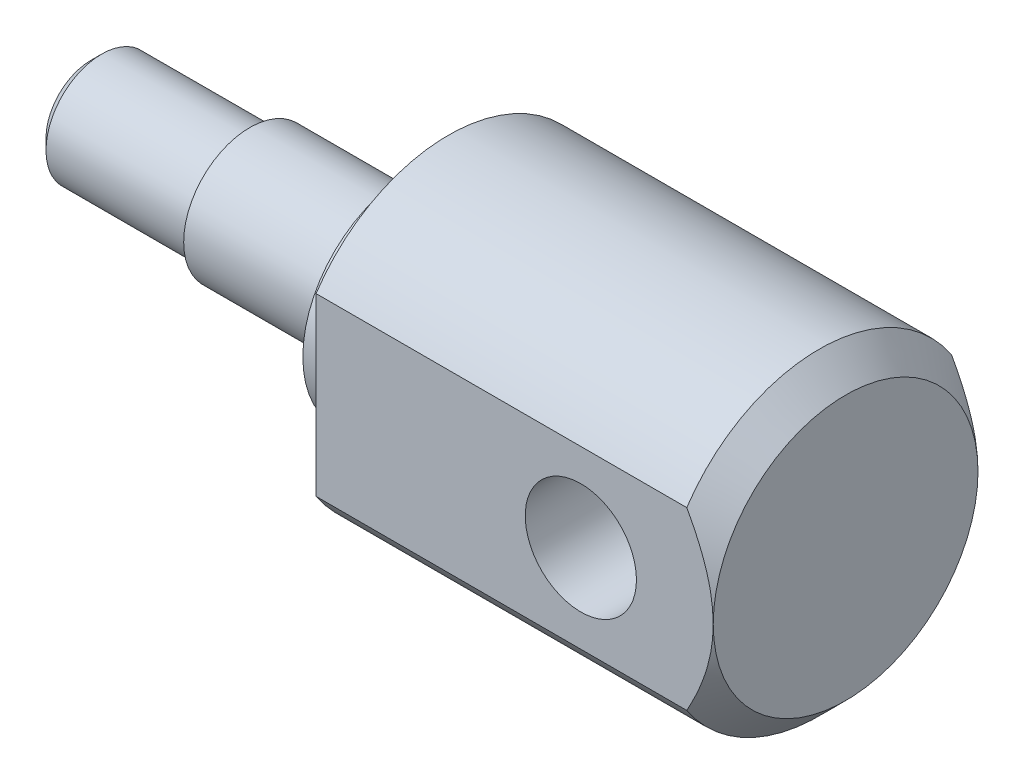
SolidWorks part; units mm, degrees
ref_plane "Front Plane" through (0, 0, 0) normal (0, 0, 1) x (1, 0, 0)
ref_plane "Top Plane" through (0, 0, 0) normal (0, 1, 0) x (1, 0, 0)
ref_plane "Right Plane" through (0, 0, 0) normal (1, 0, 0) x (0, 0, -1)
sketch "Sketch1" plane through (0, 0, 0) normal (0, 0, 1) x (1, 0, 0)
  line L0 (0, 0) -> (28.5, 0)
  line L1 (0, 0) -> (0, 2.1)
  line L2 (0, 2.1) -> (6, 2.1)
  line L3 (6, 2.1) -> (6, 2.5)
  line L4 (6, 2.5) -> (12, 2.5)
  line L5 (12, 2.5) -> (12, 4)
  line L6 (12, 4) -> (13.5, 4)
  line L7 (13.5, 4) -> (13.5, 6)
  line L8 (13.5, 6) -> (28.5, 6)
  line L9 (28.5, 6) -> (28.5, 0)
  dimension "D1" = 1.5
  dimension "D2" = 15
  dimension "D3" = 6
  dimension "D4" = 6
  dimension "D5" = 2.1
  dimension "D6" = 2.5
  dimension "D7" = 4
  dimension "D8" = 6
revolve "Revolve1" add sketch "Sketch1" angle 360 about L0
chamfer "Chamfer1" distance 0.4 angle 45 1 edges at (0, 0, 2.1)
chamfer "Chamfer2" distance 1 angle 45 1 edges at (28.5, 0, 6)
sketch "Sketch2" plane through (0, 0, 0) normal (0, 1, 0) x (1, 0, 0)
  line L0 (0, 0) -> (28.5, 0) construction
  line L1 (28.5, -5) -> (28.5, 5) construction
  line L3 (10.6957, 5) -> (31.4017, 5)
  line L4 (10.6957, 5) -> (10.6957, 8.3477)
  line L5 (10.6957, 8.3477) -> (31.4017, 8.3477)
  line L6 (31.4017, 5) -> (31.4017, 8.3477)
  line L7 (10.6957, -5) -> (31.4017, -5)
  line L8 (10.6957, -5) -> (10.6957, -7.5211)
  line L9 (10.6957, -7.5211) -> (31.4017, -7.5211)
  line L10 (31.4017, -5) -> (31.4017, -7.5211)
  dimension "D1" = 5
  dimension "D2" = 5
extrude "Extrude1" cut sketch "Sketch2" against normal mid plane 20
sketch "Sketch3" plane through (0, 0, 5) normal (0, 0, 1) x (1, 0, 0)
  line L0 (0, 0) -> (28.5, 0) construction
  line L1 (13.5, -3.3166) -> (13.5, 3.3166) construction
  point P4 (23.5, 0)
  dimension "D1" = 10
hole_wizard "M5 Tapped Hole1" positions "3DSketch1" profile "Sketch5" tap size "M5" standard "ISO"
sketch3d "3DSketch1"
  point P0 (23.5, 0, 5)
sketch "Sketch5" plane through (23.5, 0, 5) normal (1, 0, 0) x (0, -1, 0)
  line L0 (0, 0) -> (0, 10)
  line L1 (0, 10) -> (2.1, 10)
  line L2 (2.1, 10) -> (2.1, 0)
  line L5 (2.1, 0) -> (0, 0)
  line L11 (0, -6.35) -> (0, 107.95) construction
  dimension "Thru Tap Drill Dia." = 4.2
  dimension "Thru Tap Drill Depth" = 10
